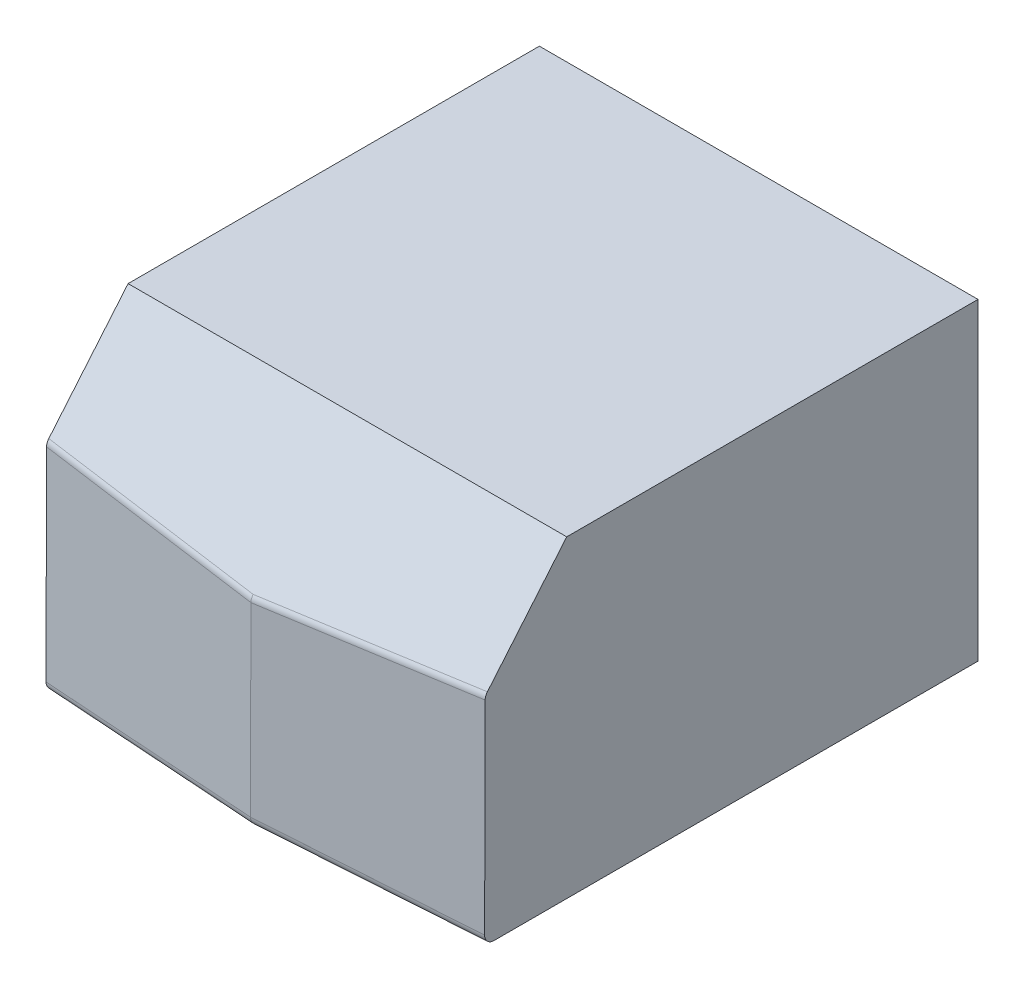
SolidWorks part; units mm, degrees
ref_plane "Y" through (0, 0, 0) normal (0, 0, 1) x (1, 0, 0)
ref_plane "Z" through (0, 0, 0) normal (0, 1, 0) x (1, 0, 0)
ref_plane "X" through (0, 0, 0) normal (1, 0, 0) x (0, 0, -1)
imported_body "Importiert1"
ref_plane "Ebene1" through (15, 0, 0) normal (1, 0, 0) x (0, 0, -1)
other "Oberflächenschnitt1"
other "Fläche verschieben1"
mirror "Spiegeln1" about plane through (0, 0, 0) normal (1, 0, 0)
